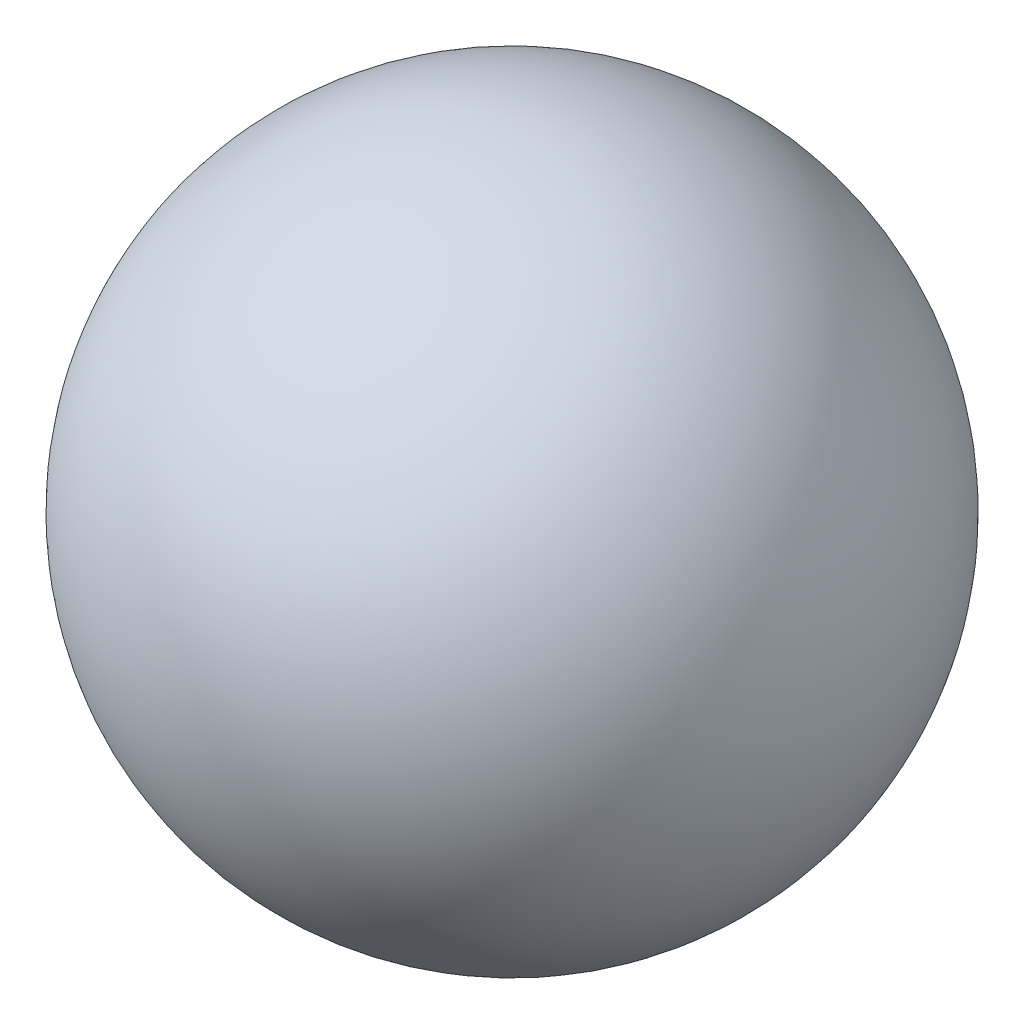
SolidWorks part; units mm, degrees
ref_plane "Plan1" through (0, 0, 0) normal (0, 0, 1) x (1, 0, 0)
ref_plane "Plan2" through (0, 0, 0) normal (0, 1, 0) x (1, 0, 0)
ref_plane "Plan3" through (0, 0, 0) normal (1, 0, 0) x (0, 0, -1)
sketch "Esquisse1" plane through (0, 0, 0) normal (0, 1, 0) x (1, 0, 0)
  line L1 (-0.3, 1.95) -> (4.7, 1.95) construction
  line L2 (-0.3, 3.9) -> (-0.3, 0) construction
  line L3 (4.7, 3.9) -> (4.7, 0) construction
  line L4 (0.85, 1.95) -> (3.55, 1.95)
  circle A1 centre (2.2, 1.95) radius 1.35 construction
  arc A2 (3.55, 1.95) -> (0.85, 1.95) centre (2.2, 1.95) ccw
revolve "Base-Révolution" add sketch "Esquisse1" angle 360 about L1
